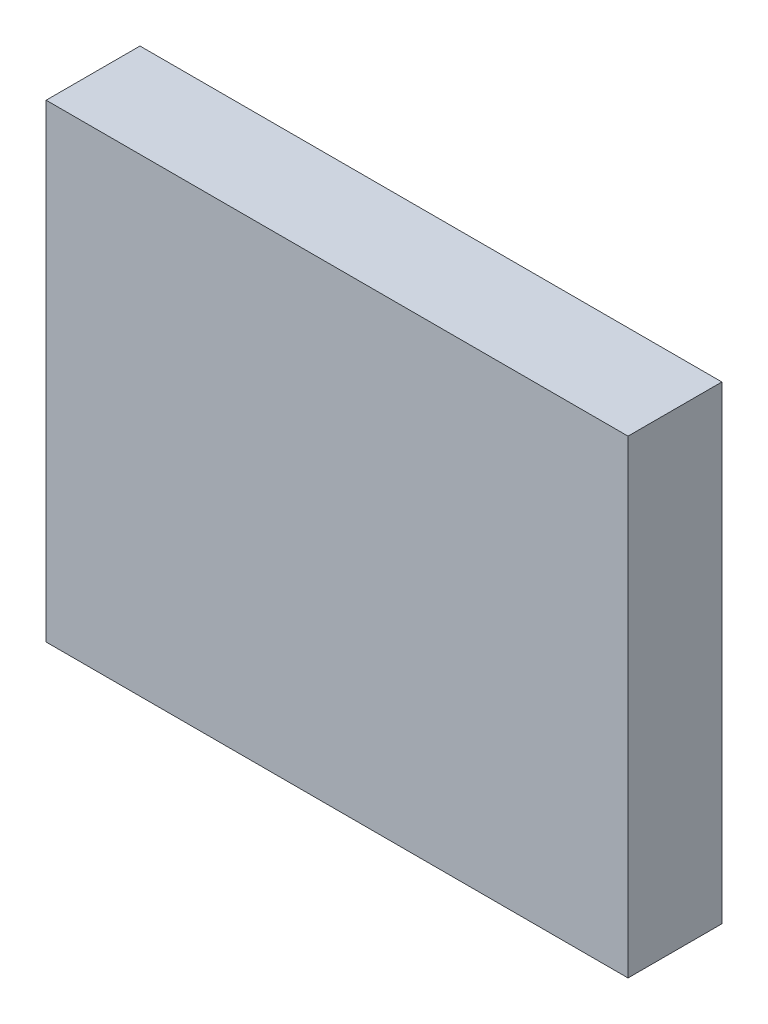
SolidWorks part; units mm, degrees
ref_plane "Plan de face" through (0, 0, 0) normal (0, 0, 1) x (1, 0, 0)
ref_plane "Plan de dessus" through (0, 0, 0) normal (0, 1, 0) x (1, 0, 0)
ref_plane "Plan de droite" through (0, 0, 0) normal (1, 0, 0) x (0, 0, -1)
sketch "Esquisse1" plane through (0, 0, 0) normal (0, 0, 1) x (1, 0, 0)
  line L1 (0, 0) -> (62, 0)
  line L2 (0, 0) -> (0, 50)
  line L3 (0, 50) -> (62, 50)
  line L4 (62, 0) -> (62, 50)
  dimension "D1" = 62
  dimension "D2" = 50
extrude "Boss.-Extru.1" add sketch "Esquisse1" along normal blind 10
